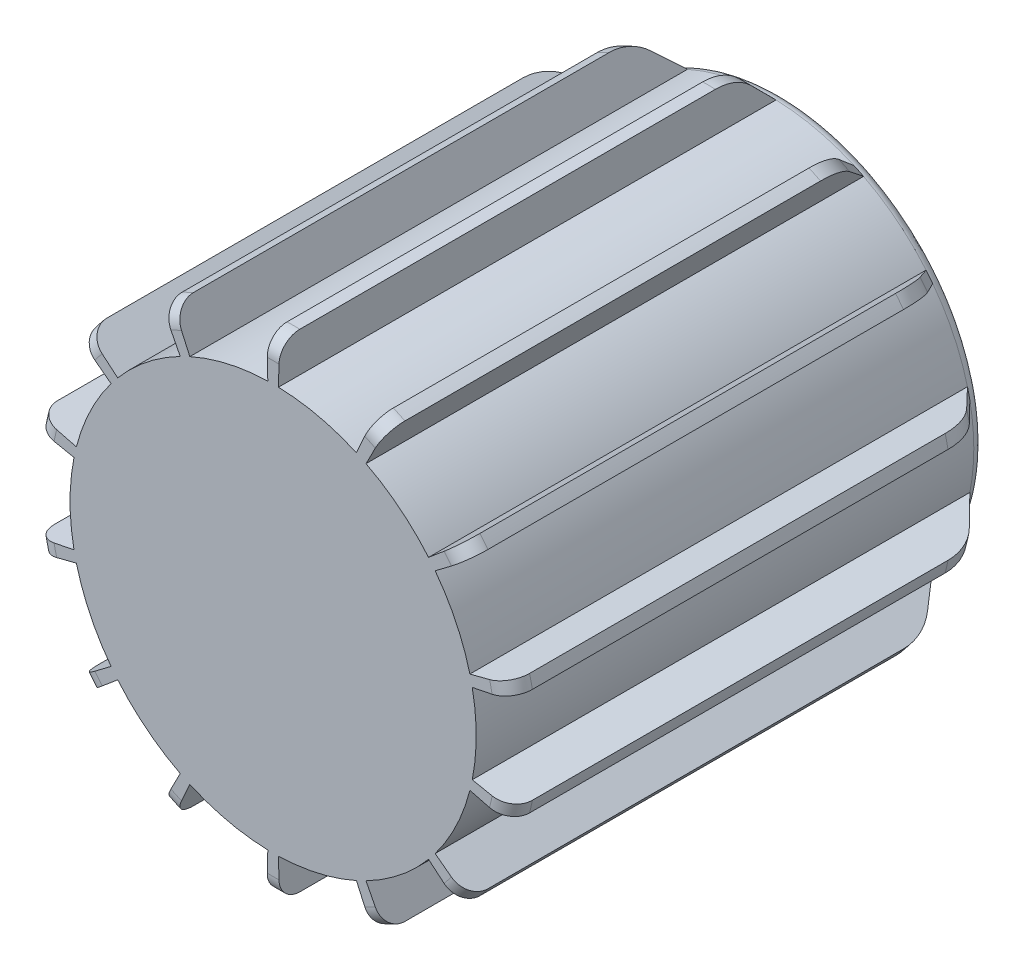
SolidWorks part; units mm, degrees
ref_plane "Front Plane" through (0, 0, 0) normal (0, 0, 1) x (1, 0, 0)
ref_plane "Top Plane" through (0, 0, 0) normal (0, 1, 0) x (1, 0, 0)
ref_plane "Right Plane" through (0, 0, 0) normal (1, 0, 0) x (0, 0, -1)
sketch "Sketch1" plane through (0, 0, 0) normal (0, 0, 1) x (1, 0, 0)
  circle A0 centre (0, 0) radius 32.5
  circle A1 centre (0, 0) radius 22.5
  dimension "D1" = 45
  dimension "D2" = 65
extrude "Extrude1" add sketch "Sketch1" along normal blind 25
sketch "Sketch2" plane through (0, 0, 25) normal (0, 0, 1) x (1, 0, 0)
  circle A0 centre (0, 0) radius 100
  dimension "D1" = 200
extrude "Extrude2" add sketch "Sketch2" along normal blind 250
fillet "Fillet1" radius 5 1 edges at (32.5, 0, 25)
fillet "Fillet2" radius 5 1 edges at (100, 0, 25)
sketch "Sketch3" plane through (0, 0, 0) normal (1, 0, 0) x (0, 0, -1)
  line L1 (-50, -120) -> (-275, -120)
  line L2 (-275, -120) -> (-275, -95)
  line L4 (-25, -95) -> (-50, -120)
  line L5 (-275, -95) -> (-25, -95)
  line L8 (0, 0) -> (-187.6733, 0) construction
  line L11 (-25, -95) -> (-25, 95) construction
  line L12 (-275, -100) -> (-30, -100) construction
  line L13 (-30, 100) -> (-30, -100) construction
  line L14 (-275, 100) -> (-275, -100) construction
  point P10 (-30, -100)
  dimension "D1" = 45
  dimension "D2" = 25
revolve "Revolve1" add sketch "Sketch3" angle 3 about L8
fillet "Fillet3" radius 25 1 edges at (0, -120, 50)
fillet "Fillet4" radius 10 1 edges at (0, -120, 275)
pattern_circular "CirPattern1" count 14 over 360 about axis through (0, 0, 0) along (0, 0, 1) of "Revolve1", "Fillet3", "Fillet4"
